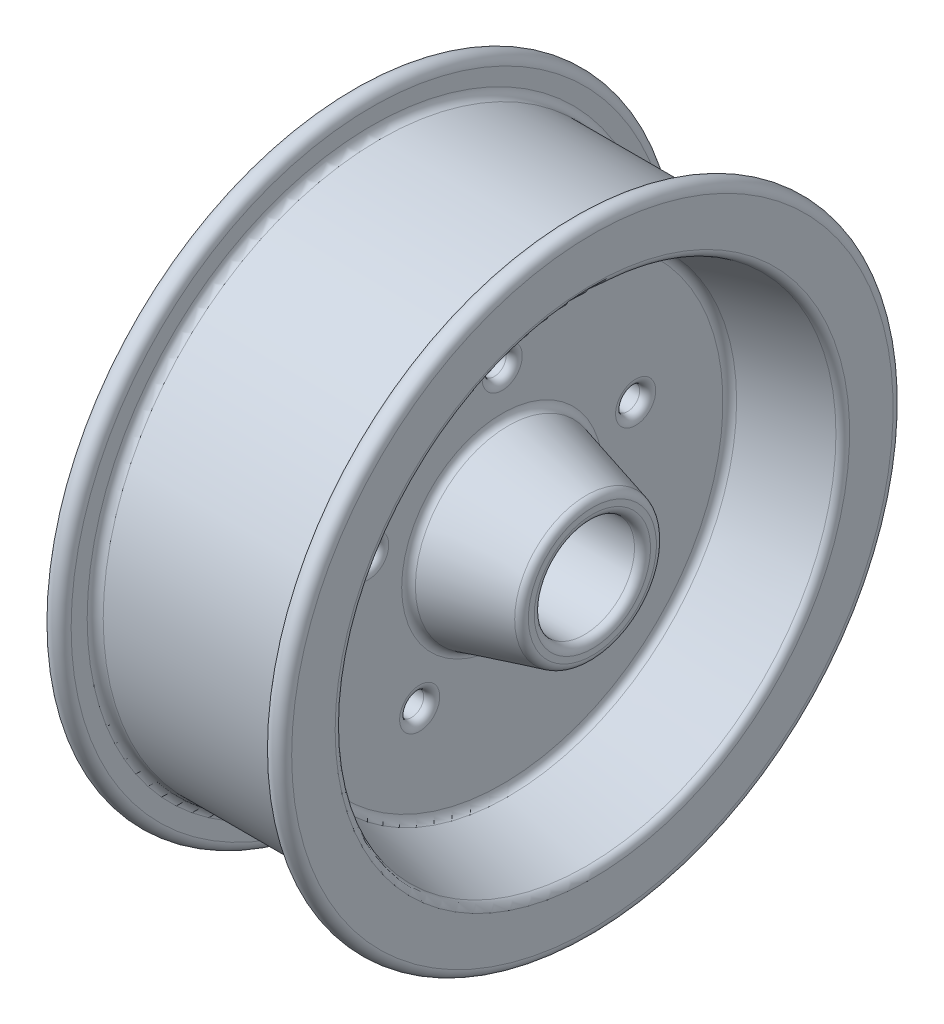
SolidWorks part; units mm, degrees
ref_plane "Front Plane" through (0, 0, 0) normal (0, 0, 1) x (1, 0, 0)
ref_plane "Top Plane" through (0, 0, 0) normal (0, 1, 0) x (1, 0, 0)
ref_plane "Right Plane" through (0, 0, 0) normal (1, 0, 0) x (0, 0, -1)
sketch "Sketch1" plane through (0, 0, 0) normal (0, 0, 1) x (1, 0, 0)
  line L0 (0, 0) -> (0, 83.8297) construction
  line L1 (-47.3164, 0) -> (44.6716, 0) construction
  line L2 (35.56, 15.875) -> (-35.56, 15.875)
  line L3 (38.1, 18.415) -> (38.1, 20.276)
  line L4 (-38.1, 18.415) -> (-38.1, 20.276)
  line L5 (36.2174, 22.7294) -> (11.4076, 29.3772)
  line L6 (-36.2174, 22.7294) -> (-11.4076, 29.3772)
  line L7 (9.525, 31.8307) -> (9.525, 69.9217)
  line L8 (-9.525, 31.8307) -> (-9.525, 69.9217)
  line L9 (11.4076, 72.3752) -> (36.2174, 79.023)
  line L10 (-11.4076, 72.3752) -> (-36.2174, 79.023)
  line L11 (38.1, 81.4764) -> (38.1, 95.25)
  line L12 (-38.1, 81.4764) -> (-38.1, 95.25)
  line L13 (31.75, 95.25) -> (31.75, 90.17)
  line L14 (-31.75, 95.25) -> (-31.75, 90.17)
  line L15 (29.21, 87.63) -> (-29.21, 87.63)
  arc A0 (31.75, 95.25) -> (38.1, 95.25) centre (34.925, 95.25) cw
  arc A1 (-31.75, 95.25) -> (-38.1, 95.25) centre (-34.925, 95.25) ccw
  arc A2 (-11.4076, 29.3772) -> (-9.525, 31.8307) centre (-12.065, 31.8307) ccw
  arc A3 (-31.75, 90.17) -> (-29.21, 87.63) centre (-29.21, 90.17) ccw
  arc A4 (31.75, 90.17) -> (29.21, 87.63) centre (29.21, 90.17) cw
  arc A5 (36.2174, 79.023) -> (38.1, 81.4764) centre (35.56, 81.4764) ccw
  arc A6 (-36.2174, 79.023) -> (-38.1, 81.4764) centre (-35.56, 81.4764) cw
  arc A7 (9.525, 69.9217) -> (11.4076, 72.3752) centre (12.065, 69.9217) cw
  arc A8 (-9.525, 69.9217) -> (-11.4076, 72.3752) centre (-12.065, 69.9217) ccw
  arc A9 (11.4076, 29.3772) -> (9.525, 31.8307) centre (12.065, 31.8307) cw
  arc A10 (-38.1, 20.276) -> (-36.2174, 22.7294) centre (-35.56, 20.276) cw
  arc A11 (38.1, 20.276) -> (36.2174, 22.7294) centre (35.56, 20.276) ccw
  arc A12 (35.56, 15.875) -> (38.1, 18.415) centre (35.56, 18.415) ccw
  arc A13 (-38.1, 18.415) -> (-35.56, 15.875) centre (-35.56, 18.415) ccw
  point P21 (0, 87.63)
  point P23 (0, 15.875)
  point P27 (-9.525, 29.8816)
  point P30 (-31.75, 87.63)
  point P33 (31.75, 87.63)
  point P36 (38.1, 79.5274)
  point P39 (-38.1, 79.5274)
  point P42 (9.525, 71.8708)
  point P45 (-9.525, 71.8708)
  point P48 (9.525, 29.8816)
  point P51 (-38.1, 22.225)
  point P54 (38.1, 22.225)
  point P57 (38.1, 15.875)
  point P60 (-38.1, 15.875)
  dimension "D4" = 196.85
  dimension "D10" = 2.54
  dimension "D1" = 19.05
  dimension "D2" = 57.3024
  dimension "D3" = 175.26
  dimension "D5" = 6.35
  dimension "D6" = 15
  dimension "D7" = 6.35
  dimension "D8" = 31.75
  dimension "D9" = 38.1
revolve "Revolve1" add sketch "Sketch1" angle 360 about L1
sketch "Sketch2" plane through (9.525, 0, 0) normal (1, 0, 0) x (0, 0, -1)
  line L0 (0, 0) -> (0, 105.1093) construction
  circle A0 centre (0, 0) radius 44.45 construction
  circle A1 centre (0, 44.45) radius 3.81
  circle A2 centre (42.2745, 13.7358) radius 3.81
  circle A3 centre (26.1271, -35.9608) radius 3.81
  circle A4 centre (-26.1271, -35.9608) radius 3.81
  circle A5 centre (-42.2745, 13.7358) radius 3.81
  point P17 (0, 0)
  dimension "D1" = 88.9
  dimension "D2" = 7.62
  dimension "D3" = 5
extrude "Cut-Extrude2" cut sketch "Sketch2" against normal through all
fillet "Fillet1" radius 2.54 10 edges at (-9.525, -35.9608, 22.3171) (-9.525, -35.9608, -29.9371) (-9.525, 13.7358, -46.0845) (-9.525, 44.45, -3.81) (-9.525, 13.7358, 38.4645) (9.525, -35.9608, 22.3171) (9.525, -35.9608, -29.9371) (9.525, 13.7358, -46.0845) (9.525, 44.45, -3.81) (9.525, 13.7358, 38.4645)
